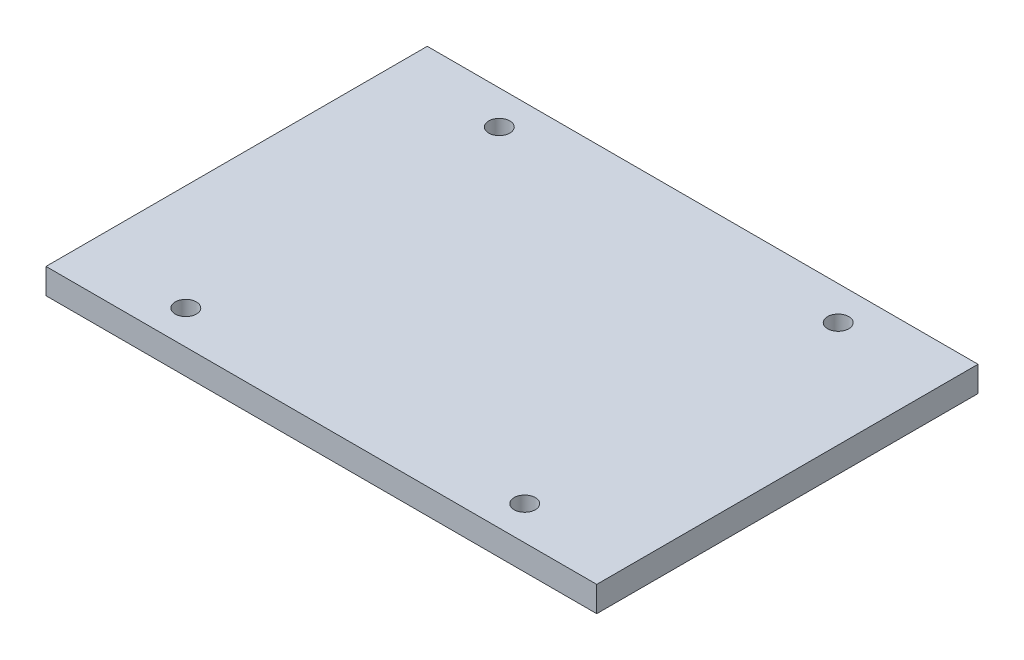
SolidWorks part; units mm, degrees
ref_plane "Front Plane" through (0, 0, 0) normal (0, 0, 1) x (1, 0, 0)
ref_plane "Top Plane" through (0, 0, 0) normal (0, 1, 0) x (1, 0, 0)
ref_plane "Right Plane" through (0, 0, 0) normal (1, 0, 0) x (0, 0, -1)
sketch "Sketch1" plane through (0, 0, 0) normal (0, 1, 0) x (1, 0, 0)
  line L1 (32.5, -22.5) -> (-32.5, -22.5)
  line L2 (32.5, -22.5) -> (32.5, 22.5)
  line L3 (32.5, 22.5) -> (-32.5, 22.5)
  line L4 (-32.5, -22.5) -> (-32.5, 22.5)
  line L5 (32.5, -22.5) -> (-32.5, 22.5) construction
  line L6 (32.5, 22.5) -> (-32.5, -22.5) construction
  line L7 (20, -18.5) -> (-20, -18.5) construction
  line L8 (20, -18.5) -> (20, 18.5) construction
  line L9 (20, 18.5) -> (-20, 18.5) construction
  line L10 (-20, -18.5) -> (-20, 18.5) construction
  line L11 (20, -18.5) -> (-20, 18.5) construction
  line L12 (20, 18.5) -> (-20, -18.5) construction
  circle A0 centre (-20, 18.5) radius 1.25
  circle A1 centre (-20, -18.5) radius 1.25
  circle A2 centre (20, -18.5) radius 1.25
  circle A3 centre (20, 18.5) radius 1.25
  point P0 (0, 0)
  point P6 (0, 0)
  dimension "D5" = 2.5
  dimension "D1" = 65
  dimension "D2" = 45
  dimension "D3" = 40
  dimension "D4" = 37
extrude "Boss-Extrude1" add sketch "Sketch1" along normal blind 3
